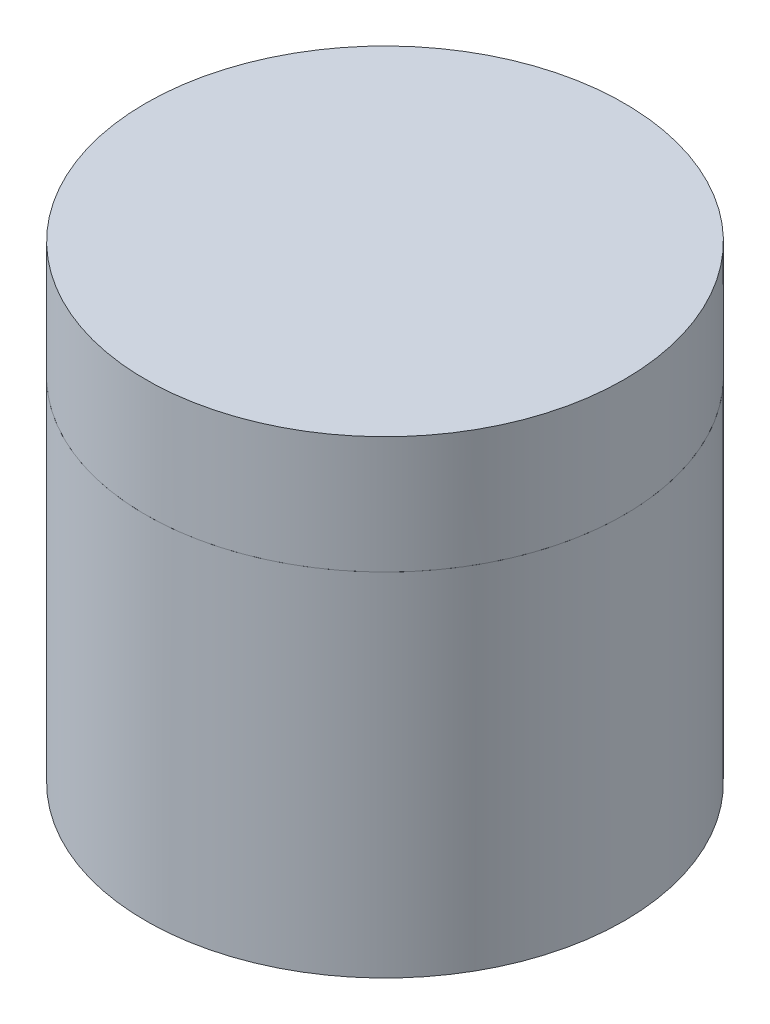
SolidWorks part; units mm, degrees
ref_plane "Front Plane" through (0, 0, 0) normal (0, 0, 1) x (1, 0, 0)
ref_plane "Top Plane" through (0, 0, 0) normal (0, 1, 0) x (1, 0, 0)
ref_plane "Right Plane" through (0, 0, 0) normal (1, 0, 0) x (0, 0, -1)
imported_body "Imported1"
other "Parting Line1"
other "Parting Surface1" parameters "D1"=127
sketch "Sketch1" plane through (0, -3.7095, 0) normal (0, -1, 0) x (1, 0, 0)
  circle A0 centre (0, 0) radius 31.115
  dimension "D1" = 62.23
other "Tooling Split1" parameters "D1"=15.24, "D2"=45.72, "D3"=3
sketch "Sketch2" plane through (0, -3.7095, 0) normal (0, -1, 0) x (1, 0, 0)
  circle A0 centre (0, 0) radius 20.32 construction
  circle A1 centre (0, 0) radius 20.32
